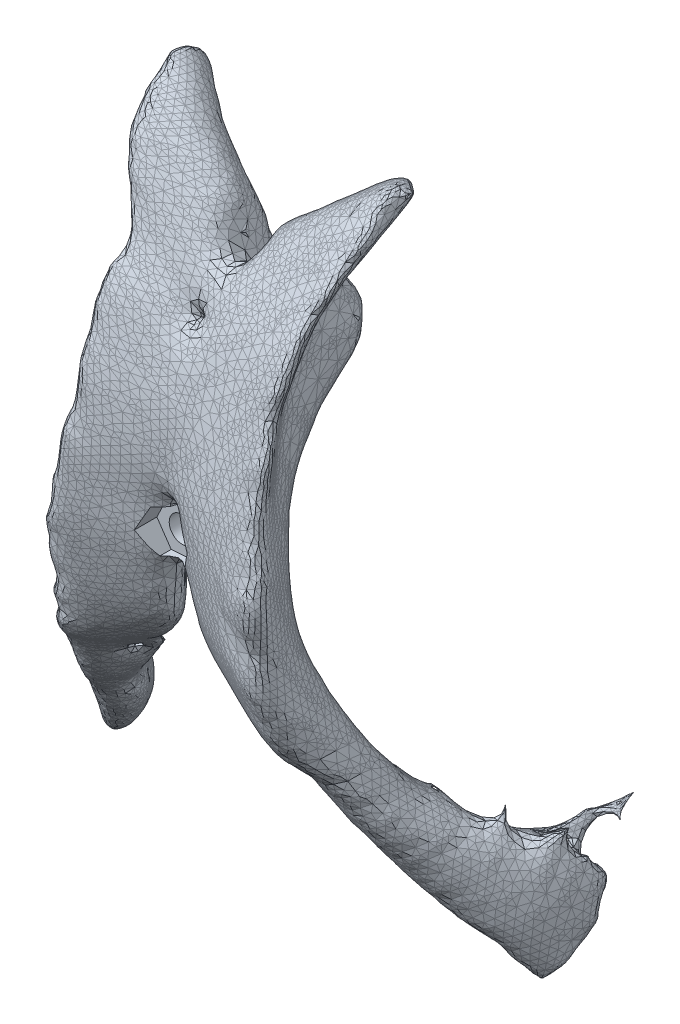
SolidWorks part; units mm, degrees
ref_plane "前视基准面" through (0, 0, 0) normal (0, 0, 1) x (1, 0, 0)
ref_plane "上视基准面" through (0, 0, 0) normal (0, 1, 0) x (1, 0, 0)
ref_plane "右视基准面" through (0, 0, 0) normal (1, 0, 0) x (0, 0, -1)
imported_body "输入1"
ref_plane "基准面5" through (0, 0, 22.8152) normal (0, 0, 1) x (1, 0, 0)
sketch "草图4" plane through (0, 0, 22.8152) normal (0, 0, 1) x (1, 0, 0)
  circle A0 centre (-2.1607, 3.1641) radius 1.7
  dimension "D1" = 3.4
sketch "草图6" plane through (0, 0, 0) normal (0, 0, 1) x (1, 0, 0)
  circle A0 centre (-2.1607, 3.1641) radius 1.7
extrude "切除-拉伸7" cut sketch "草图6" along normal through all
sketch "草图7" plane through (0, 0, 0) normal (0, 0, 1) x (1, 0, 0)
  circle A0 centre (-2.1607, 3.1641) radius 3
  dimension "D1" = 6
extrude "切除-拉伸8" cut sketch "草图7" along normal up to surface (22.8152 mm away)
ref_plane "基准面6" through (0, 0, 40) normal (0, 0, 1) x (1, 0, 0)
sketch "草图8" plane through (0, 0, 40) normal (0, 0, 1) x (1, 0, 0)
  line L1 (-0.2886, 0.4226) -> (1.1495, 3.4147)
  line L2 (1.1495, 3.4147) -> (-0.7226, 6.1562)
  line L3 (-0.7226, 6.1562) -> (-4.0329, 5.9056)
  line L4 (-4.0329, 5.9056) -> (-5.471, 2.9135)
  line L5 (-5.471, 2.9135) -> (-3.5989, 0.172)
  line L6 (-3.5989, 0.172) -> (-0.2886, 0.4226)
  circle A0 centre (-2.1607, 3.1641) radius 2.875 construction
  dimension "D1" = 5.75
extrude "切除-拉伸9" cut sketch "草图8" against normal blind 15
